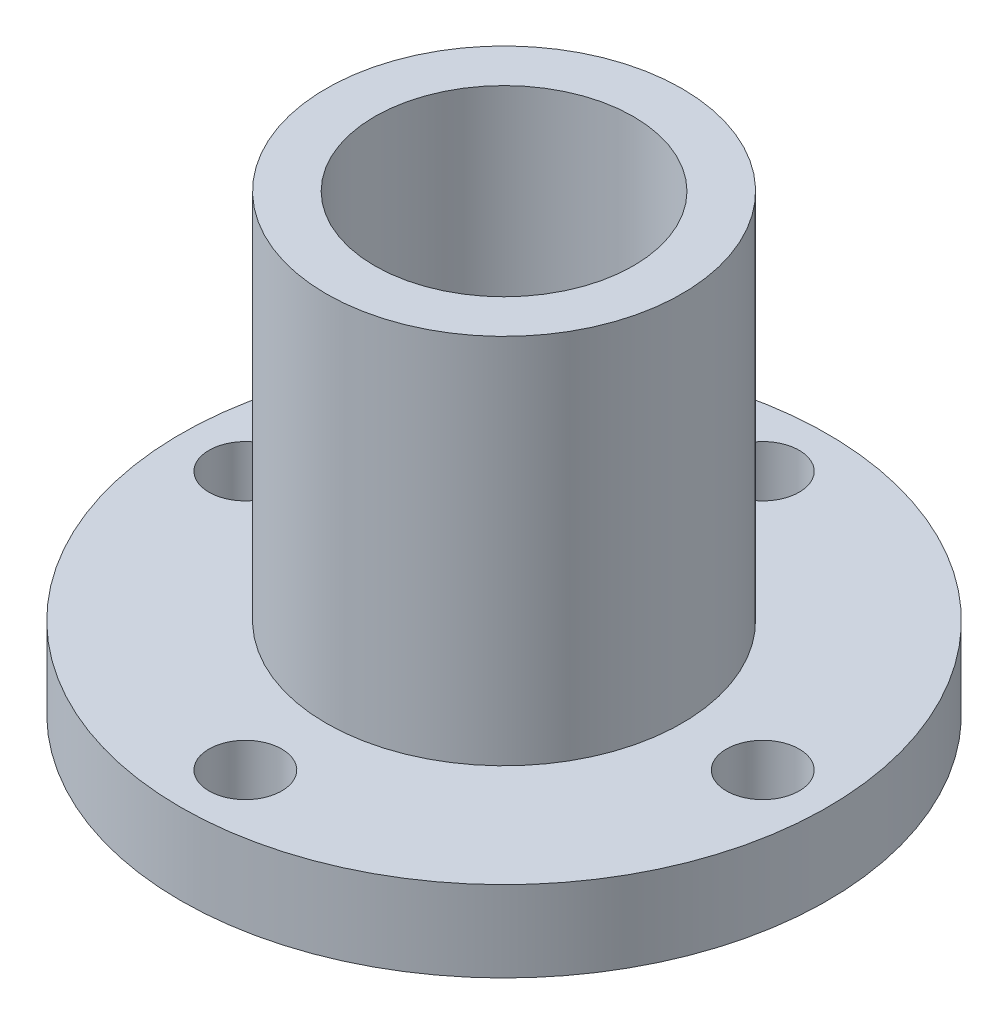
SolidWorks part; units mm, degrees
ref_plane "前视基准面" through (0, 0, 0) normal (0, 0, 1) x (1, 0, 0)
ref_plane "上视基准面" through (0, 0, 0) normal (0, 1, 0) x (1, 0, 0)
ref_plane "右视基准面" through (0, 0, 0) normal (1, 0, 0) x (0, 0, -1)
other "Configuration Table"
sketch "草图1" plane through (0, 0, 0) normal (0, 1, 0) x (1, 0, 0)
  circle A0 centre (0, 0) radius 20
  dimension "D1" = 40
extrude "凸台-拉伸1" add sketch "草图1" along normal blind 28
sketch "草图2" plane through (0, 28, 0) normal (0, 1, 0) x (1, 0, 0)
  circle A0 centre (0, 0) radius 11
  dimension "D1" = 22
extrude "切除-拉伸1" cut sketch "草图2" against normal blind 23 flip side to cut
sketch "草图3" plane through (0, 28, 0) normal (0, 1, 0) x (1, 0, 0)
  circle A0 centre (0, 0) radius 8
  dimension "D1" = 16
extrude "切除-拉伸2" cut sketch "草图3" against normal blind 28
sketch "草图4" plane through (0, 0, 0) normal (0, -1, 0) x (1, 0, 0)
  line L0 (0, 20) -> (0, -20) construction
  line L1 (20, 0) -> (-20, 0) construction
  circle A0 centre (0, 0) radius 20 construction
  circle A1 centre (0, 16) radius 2.25
  circle A2 centre (16, 0) radius 2.25
  circle A5 centre (0, -16) radius 2.25
  circle A6 centre (-16, 0) radius 2.25
  dimension "D1" = 16
  dimension "D2" = 4.5
  dimension "D3" = 16
  dimension "D4" = 4.5
extrude "切除-拉伸3" cut sketch "草图4" against normal blind 5
